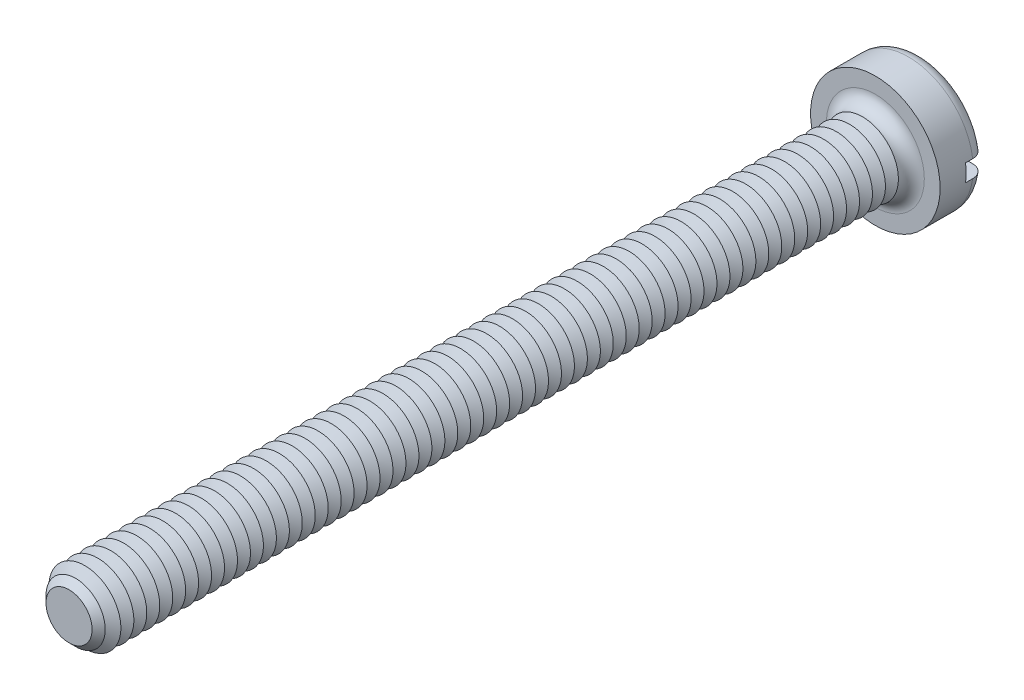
SolidWorks part; units mm, degrees
ref_plane "Front Plane" through (0, 0, 0) normal (0, 0, 1) x (1, 0, 0)
ref_plane "Top Plane" through (0, 0, 0) normal (0, 1, 0) x (1, 0, 0)
ref_plane "Right Plane" through (0, 0, 0) normal (1, 0, 0) x (0, 0, -1)
sketch "Sketch3" plane through (0, 0, 0) normal (0, 0, 1) x (1, 0, 0)
  circle A0 centre (0, 0) radius 2.25
  dimension "D1" = 4.5
extrude "Boss-Extrude2" add sketch "Sketch3" against normal blind 1.6
sketch "Sketch4" plane through (0, 0, 0) normal (0, 0, 1) x (1, 0, 0)
  circle A0 centre (0, 0) radius 1.25
  dimension "D1" = 2.5
extrude "Boss-Extrude3" add sketch "Sketch4" along normal blind 28
fillet "Fillet1" radius 0.45 2 edges at (2.25, 0, -1.6) (1.25, 0, 0)
chamfer "Chamfer1" distance 0.45 angle 45 1 edges at (1.25, 0, 28)
sketch "Sketch5" plane through (0, 0, 0) normal (1, 0, 0) x (0, 0, -1)
  line L0 (1.6944, 0) -> (-7.6738, 0) construction
sketch "Sketch6" plane through (0, 0, 0) normal (1, 0, 0) x (0, 0, -1)
  line L0 (-0.45, 1.25) -> (-0.675, 0.8603)
  line L1 (-0.675, 0.8603) -> (-0.9, 1.25)
  line L2 (-0.45, 1.25) -> (-27.55, 1.25) construction
  line L3 (-0.9, 1.25) -> (-0.45, 1.25)
  dimension "D1" = 0.45
revolve "Cut-Revolve1" cut sketch "Sketch6" angle 360 about L0
pattern_linear "LPattern1" count 61 spacing 0.45 along (0, 0, 1) of "Cut-Revolve1"
sketch "Sketch8" plane through (0, 0, -1.6) normal (0, 0, -1) x (-1, 0, 0)
  line L1 (2.25, -0.3) -> (-2.25, -0.3)
  line L2 (2.25, -0.3) -> (2.25, 0.3)
  line L3 (2.25, 0.3) -> (-2.25, 0.3)
  line L4 (-2.25, -0.3) -> (-2.25, 0.3)
  line L5 (2.25, -0.3) -> (-2.25, 0.3) construction
  line L6 (2.25, 0.3) -> (-2.25, -0.3) construction
  point P0 (0, 0)
  dimension "D1" = 4.5
  dimension "D2" = 0.6
extrude "Cut-Extrude1" cut sketch "Sketch8" against normal blind 0.7
